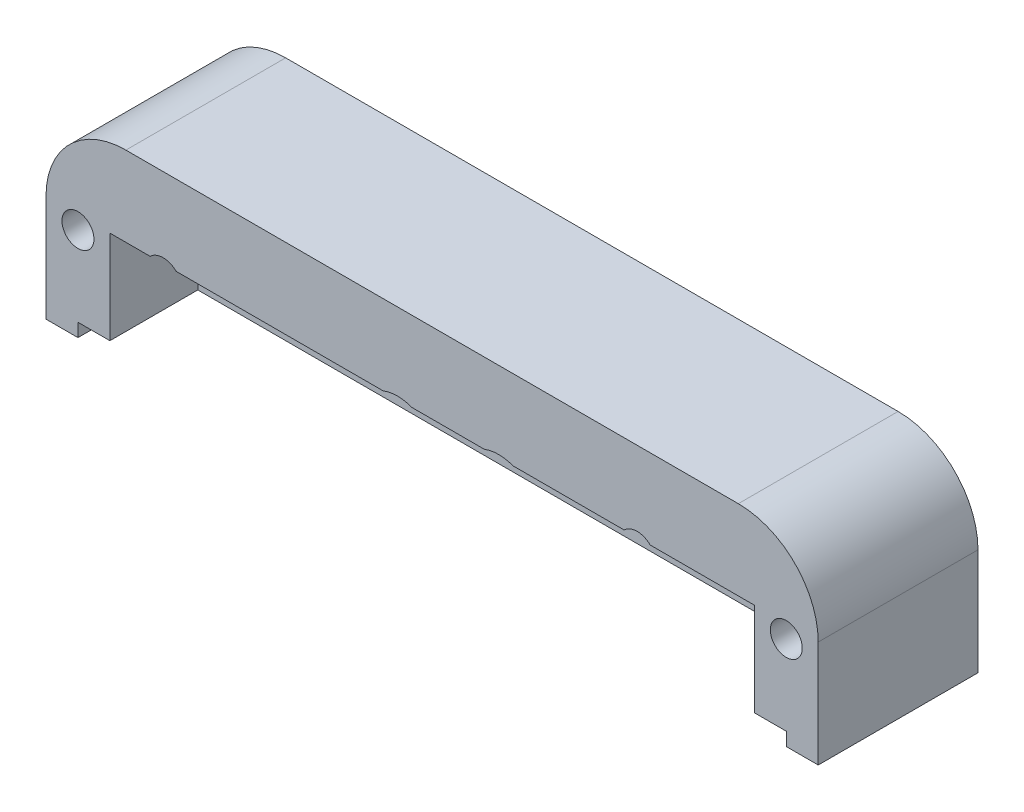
SolidWorks part; units mm, degrees
other "<box>-<Вырез-Вытянуть10>"
ref_plane "Спереди" through (0, 0, 0) normal (0, 0, 1) x (1, 0, 0)
ref_plane "Сверху" through (0, 0, 0) normal (0, 1, 0) x (1, 0, 0)
ref_plane "Справа" through (0, 0, 0) normal (1, 0, 0) x (0, 0, -1)
sketch "Эскиз1-box" plane through (-1.3084, 1.0816, 0.227) normal (0, 0, 1) x (1, 0, 0)
  line L0 (0, 0) -> (0, 35) construction
  line L1 (72.5, 0) -> (-72.5, 0)
  line L2 (-72.5, 0) -> (-72.5, 20)
  line L3 (-57.5, 35) -> (57.5, 35)
  line L4 (72.5, 20) -> (72.5, 0)
  arc A0 (-72.5, 20) -> (-57.5, 35) centre (-57.5, 20) cw
  arc A1 (57.5, 35) -> (72.5, 20) centre (57.5, 20) cw
  point P6 (0, 0)
  dimension "D3" = 15
  dimension "D1" = 145
  dimension "D2" = 35
sketch "Эскиз2-box" plane through (-1.3084, 1.0816, 0.227) normal (0, -1, 0) x (1, 0, 0)
  line L0 (0, 90) -> (0, 0) construction
  line L2 (-72.5, 45) -> (72.5, 45) construction
  line L6 (-60.5, 76.5) -> (60.5, 76.5)
  line L7 (-60.5, 76.5) -> (-60.5, 13.5)
  line L8 (-60.5, 13.5) -> (60.5, 13.5)
  line L9 (60.5, 76.5) -> (60.5, 13.5)
  line L10 (-60.5, 76.5) -> (60.5, 13.5) construction
  line L11 (-60.5, 13.5) -> (60.5, 76.5) construction
  point P11 (0, 45)
  dimension "D1" = 121
  dimension "D2" = 63
sketch "Эскиз3-box" plane through (-1.3084, 1.0816, 0.227) normal (0, -1, 0) x (1, 0, 0)
  line L0 (0, 90) -> (0, 0) construction
  line L2 (-72.5, 45) -> (72.5, 45) construction
  line L6 (-63.5, 81.5) -> (63.5, 81.5)
  line L7 (-66.5, 78.5) -> (-66.5, 11.5)
  line L8 (-63.5, 8.5) -> (63.5, 8.5)
  line L9 (66.5, 78.5) -> (66.5, 11.5)
  line L10 (-66.5, 81.5) -> (66.5, 8.5) construction
  line L11 (-66.5, 8.5) -> (66.5, 81.5) construction
  arc A0 (63.5, 81.5) -> (66.5, 78.5) centre (63.5, 78.5) cw
  arc A1 (63.5, 8.5) -> (66.5, 11.5) centre (63.5, 11.5) ccw
  arc A2 (-66.5, 11.5) -> (-63.5, 8.5) centre (-63.5, 11.5) ccw
  arc A3 (-63.5, 81.5) -> (-66.5, 78.5) centre (-63.5, 78.5) ccw
  point P11 (0, 45)
  dimension "D3" = 3
  dimension "D1" = 133
  dimension "D2" = 73
sketch "Эскиз4-box" plane through (-1.3084, 1.0816, 90.227) normal (0, 0, 1) x (1, 0, 0)
  line L4 (37.5, 35) -> (37.5, 18) construction
  line L6 (35, 28) -> (35, 21.1623)
  line L7 (40, 28) -> (40, 21.1623)
  line L12 (-67.5, 20) -> (-67.5, 7)
  line L13 (-65.5, 5) -> (65.5, 5)
  line L14 (67.5, 7) -> (67.5, 20)
  line L15 (57.5, 30) -> (42, 30)
  line L16 (40, 35) -> (40, 18) construction
  line L17 (35, 35) -> (35, 18) construction
  line L18 (33, 30) -> (-57.5, 30)
  arc A2 (34.6364, 20.0124) -> (40.3636, 20.0124) centre (37.5, 18) ccw
  arc A3 (34.6364, 20.0124) -> (35, 21.1623) centre (33, 21.1623) ccw
  arc A6 (67.5, 20) -> (57.5, 30) centre (57.5, 20) ccw
  arc A7 (-57.5, 30) -> (-67.5, 20) centre (-57.5, 20) ccw
  arc A8 (40, 21.1623) -> (40.3636, 20.0124) centre (42, 21.1623) ccw
  arc A9 (65.5, 5) -> (67.5, 7) centre (65.5, 7) ccw
  arc A10 (-67.5, 7) -> (-65.5, 5) centre (-65.5, 7) ccw
  arc A11 (40, 28) -> (42, 30) centre (42, 28) cw
  arc A12 (35, 28) -> (33, 30) centre (33, 28) ccw
  point P42 (35, 30)
  dimension "D3" = 7
  dimension "D7" = 2
  dimension "D2" = 30
  dimension "D6" = 12
  dimension "D4" = 2.5
  dimension "D5" = 2.5
sketch "Эскиз5-box" plane through (-1.3084, 1.0816, 90.227) normal (0, 0, 1) x (1, 0, 0)
  circle A0 centre (37.5, 18) radius 1.5
  dimension "D1" = 3
sketch "Эскиз6-box" plane through (-1.3084, 3.5816, 0.227) normal (0, -1, 0) x (1, 0, 0)
  line L0 (0, 81.5) -> (0, 8.5) construction
  line L4 (-62.5, 77.5) -> (62.5, 77.5) construction
  line L5 (-62.5, 77.5) -> (-62.5, 12.5) construction
  line L6 (-62.5, 12.5) -> (62.5, 12.5) construction
  line L7 (62.5, 77.5) -> (62.5, 12.5) construction
  line L8 (-62.5, 77.5) -> (62.5, 12.5) construction
  line L9 (-62.5, 12.5) -> (62.5, 77.5) construction
  circle A0 centre (-62.5, 77.5) radius 2
  circle A1 centre (62.5, 77.5) radius 2
  circle A2 centre (62.5, 12.5) radius 2
  circle A3 centre (-62.5, 12.5) radius 2
  point P6 (0, 45)
  dimension "D3" = 4
  dimension "D1" = 125
  dimension "D2" = 65
sketch "Эскиз7-box" plane through (-1.3084, 1.0816, 0.227) normal (0, 0, -1) x (-1, 0, 0)
  line L0 (0, 35) -> (0, 0) construction
  line L3 (0, 17.5) -> (-72.5, 17.5) construction
  circle A0 centre (-38.5, 17.5) radius 3.5
  dimension "D2" = 7
  dimension "D1" = 34
sketch "Эскиз8-box" plane through (-1.3084, 1.0816, 0.227) normal (0, 0, -1) x (-1, 0, 0)
  line L0 (0, 35) -> (0, 0) construction
  line L3 (0, 17.5) -> (72.5, 17.5) construction
  line L5 (50.5, 17.5) -> (50.5, 0) construction
  circle A1 centre (50.5, 17.5) radius 3.5
  circle A2 centre (50.5, 8.5) radius 3.5
  dimension "D1" = 7
  dimension "D2" = 9
sketch "Эскиз10-box" plane through (-1.3084, 1.0816, 0.227) normal (0, 0, -1) x (-1, 0, 0)
  line L0 (0, 35) -> (0, 0) construction
  line L3 (50.5, 17.5) -> (0, 17.5) construction
  line L4 (50.5, 8.5) -> (0, 8.5) construction
  line L6 (50.5, 17.5) -> (50.5, 8.5) construction
  line L7 (50.5, 13) -> (0, 13) construction
  circle A2 centre (-12.5, 13) radius 4
  circle A3 centre (6.5, 13) radius 4
  dimension "D1" = 8
  dimension "D2" = 19
sketch "Эскиз11-box" plane through (-1.3084, 1.0816, 0.227) normal (0, 0, -1) x (-1, 0, 0)
  circle A0 centre (-12.5, 13) radius 7.5
  circle A1 centre (6.5, 13) radius 7.5
  dimension "D1" = 15
sketch "Эскиз12-box" plane through (-1.3084, 1.0816, 90.227) normal (0, 0, 1) x (1, 0, 0)
  circle A0 centre (37.5, 18) radius 2
  dimension "D1" = 4
inserted part "box"
sketch "Эскиз12" plane through (0, 0, 90.227) normal (0, 0, 1) x (1, 0, 0)
  line L4 (-73.8084, 21.0816) -> (-73.8084, 1.0816)
  line L5 (-73.8084, 1.0816) -> (71.1916, 1.0816)
  line L6 (71.1916, 1.0816) -> (71.1916, 21.0816)
  line L7 (56.1916, 36.0816) -> (-58.8084, 36.0816)
  line L8 (-73.8084, 21.0816) -> (-73.8084, 1.0816)
  line L9 (-73.8084, 1.0816) -> (71.1916, 1.0816)
  line L10 (71.1916, 1.0816) -> (71.1916, 21.0816)
  line L11 (56.1916, 36.0816) -> (-58.8084, 36.0816)
  arc A2 (71.1916, 21.0816) -> (56.1916, 36.0816) centre (56.1916, 21.0816) ccw
  arc A3 (-58.8084, 36.0816) -> (-73.8084, 21.0816) centre (-58.8084, 21.0816) ccw
  arc A4 (71.1916, 21.0816) -> (56.1916, 36.0816) centre (56.1916, 21.0816) ccw
  arc A5 (-58.8084, 36.0816) -> (-73.8084, 21.0816) centre (-58.8084, 21.0816) ccw
  dimension "D1" = 0
extrude "Вырез-Вытянуть1" cut sketch "Эскиз12" against normal blind 60
sketch "Эскиз13" plane through (0, 0, 30.227) normal (0, 0, 1) x (1, 0, 0)
  line L0 (-1.3084, 36.0816) -> (-1.3084, 1.0816) construction
  line L1 (56.1916, 36.0816) -> (-58.8084, 36.0816) construction
  line L2 (-64.8084, 1.0816) -> (62.1916, 1.0816) construction
  line L3 (-1.3084, 18.5816) -> (-61.8084, 18.5816) construction
  line L5 (-61.8084, 18.5816) -> (-73.8084, 18.5816) construction
  line L6 (-73.8084, 21.0816) -> (-73.8084, 1.0816) construction
  line L7 (-1.3084, 18.5816) -> (59.1916, 18.5816) construction
  line L8 (59.1916, 21.0816) -> (59.1916, 3.5816) construction
  line L9 (59.1916, 18.5816) -> (71.1916, 18.5816) construction
  line L10 (71.1916, 1.0816) -> (71.1916, 21.0816) construction
  line L11 (-61.8084, 3.5816) -> (-61.8084, 21.0816) construction
  circle A0 centre (-67.8084, 18.5816) radius 3
  circle A1 centre (65.1916, 18.5816) radius 3
  dimension "D1" = 6
extrude "Вырез-Вытянуть2" cut sketch "Эскиз13" against normal blind 15
